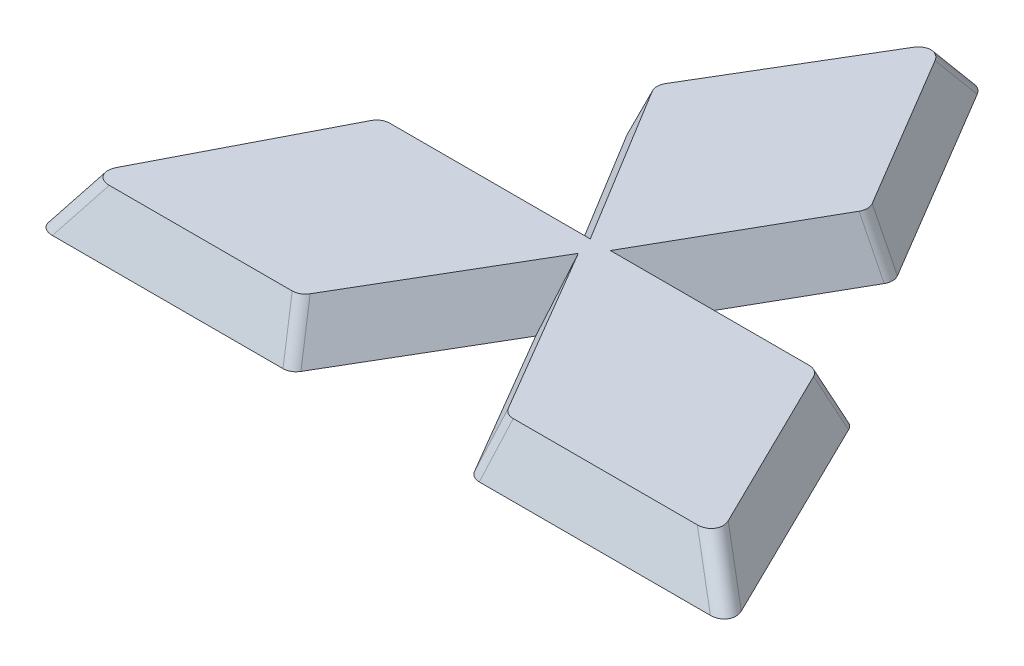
SolidWorks part; units mm, degrees
ref_plane "Front Plane" through (0, 0, 0) normal (0, 0, 1) x (1, 0, 0)
ref_plane "Top Plane" through (0, 0, 0) normal (0, 1, 0) x (1, 0, 0)
ref_plane "Right Plane" through (0, 0, 0) normal (1, 0, 0) x (0, 0, -1)
sketch "Sketch1" plane through (0, 0, 0) normal (0, 1, 0) x (1, 0, 0)
  line L3 (-48.75, -42) -> (48.75, -42) construction
  line L7 (-48.75, -42) -> (-12.6, -42)
  line L8 (48.75, -42) -> (12.6, -42)
  line L10 (-12.6, -42) -> (0, -20.5)
  line L11 (12.6, -42) -> (0, -20.5)
  line L14 (-6.25, -9) -> (-31.75, -9)
  line L17 (0, 42) -> (-18.45, 11)
  line L18 (0, 42) -> (18.45, 11)
  line L20 (32.55, -9) -> (7.05, -9)
  line L21 (-18.45, 11) -> (-6.25, -9)
  line L22 (18.45, 11) -> (7.05, -9)
  line L23 (-31.75, -9) -> (-48.75, -42)
  line L24 (32.55, -9) -> (48.75, -42)
  point P0 (0, 0)
  point P2 (0, 0)
  point P8 (0, 0)
  dimension "D3" = 25.5
  dimension "D4" = 36.15
  dimension "D5" = 25.2
  dimension "D6" = 36.15
  dimension "D7" = 21.5
  dimension "D8" = 33
  dimension "D9" = 33
  dimension "D14" = 36.7619
  dimension "D15" = 13.3
  dimension "D18" = 25.5
  dimension "D22" = 20
ref_plane "Plane2" through (0, 7, 0) normal (0, 1, 0) x (1, 0, 0)
sketch "Sketch2" plane through (0, 7, 0) normal (0, 1, 0) x (1, 0, 0)
  line L24 (0, 36.1342) -> (-14.9475, 11.0191)
  line L25 (-14.9475, 11.0191) -> (-0.9059, -12)
  line L26 (-0.9059, -12) -> (-29.9208, -12)
  line L27 (-14.3191, -39) -> (0, -14.5666)
  line L28 (-29.9208, -12) -> (-43.8299, -39)
  line L29 (-43.8299, -39) -> (-14.3191, -39)
  line L30 (0, -14.5666) -> (14.3191, -39)
  line L31 (14.3191, -39) -> (43.9353, -39)
  line L32 (43.9353, -39) -> (30.6807, -12)
  line L33 (30.6807, -12) -> (1.8869, -12)
  line L34 (1.8869, -12) -> (14.9783, 10.9674)
  line L35 (14.9783, 10.9674) -> (0, 36.1342)
  line L36 (0, 36.1342) -> (-14.9475, 11.0191)
  line L37 (-14.9475, 11.0191) -> (-0.9059, -12)
  line L38 (-0.9059, -12) -> (-29.9208, -12)
  line L39 (-14.3191, -39) -> (0, -14.5666)
  line L40 (-29.9208, -12) -> (-43.8299, -39)
  line L41 (-43.8299, -39) -> (-14.3191, -39)
  line L42 (0, -14.5666) -> (14.3191, -39)
  line L43 (14.3191, -39) -> (43.9353, -39)
  line L44 (43.9353, -39) -> (30.6807, -12)
  line L45 (30.6807, -12) -> (1.8869, -12)
  line L46 (1.8869, -12) -> (14.9783, 10.9674)
  line L47 (14.9783, 10.9674) -> (0, 36.1342)
  dimension "D1" = 3
loft "Loft7" add profiles "Sketch2", "Sketch1"
fillet "Fillet1" radius 2 9 edges
